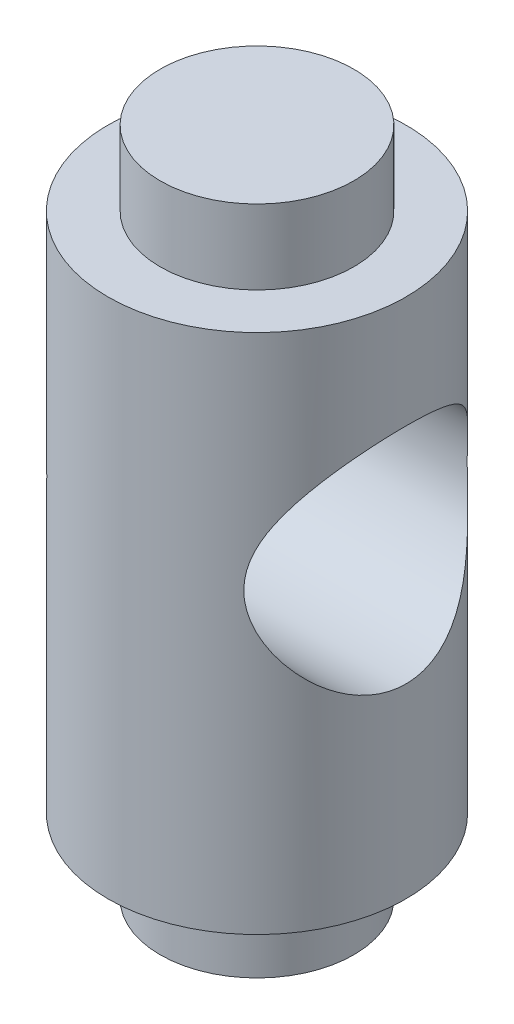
SolidWorks part; units mm, degrees
ref_plane "Front Plane" through (0, 0, 0) normal (0, 0, 1) x (1, 0, 0)
ref_plane "Top Plane" through (0, 0, 0) normal (0, 1, 0) x (1, 0, 0)
ref_plane "Right Plane" through (0, 0, 0) normal (1, 0, 0) x (0, 0, -1)
sketch "Sketch1" plane through (0, 0, 0) normal (0, 0, 1) x (1, 0, 0)
  line L0 (0, -132.2859) -> (0, 6482.0105) construction
  line L1 (-132.2859, 0) -> (6482.0105, 0) construction
  line L2 (0, 22.5) -> (0, -22.5)
  line L3 (0, -22.5) -> (-6.5, -22.5)
  line L4 (-6.5, -22.5) -> (-6.5, -17.5)
  line L5 (-6.5, -17.5) -> (-10, -17.5)
  line L6 (-10, -17.5) -> (-10, 17.5)
  line L7 (-10, 17.5) -> (-6.5, 17.5)
  line L8 (-6.5, 17.5) -> (-6.5, 22.5)
  line L9 (-6.5, 22.5) -> (0, 22.5)
  dimension "D1" = 45
  dimension "D2" = 10
  dimension "D3" = 5
  dimension "D4" = 6.5
revolve "Revolve1" add sketch "Sketch1" angle 360 about L2
sketch "Sketch2" plane through (0, 0, 0) normal (1, 0, 0) x (0, 0, -1)
  line L3 (6.5, 22.5) -> (-6.5, 22.5) construction
  circle A0 centre (0, 2.5) radius 7.5
  dimension "D1" = 15
  dimension "D2" = 20
extrude "Cut-Extrude1" cut sketch "Sketch2" along normal through all both and the other way through all
